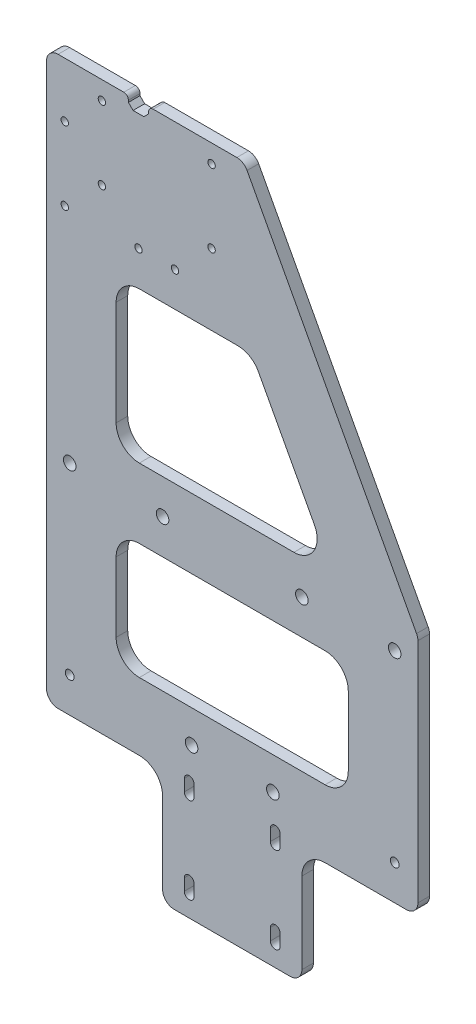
SolidWorks part; units mm, degrees
ref_plane "Front Plane" through (0, 0, 0) normal (0, 0, 1) x (1, 0, 0)
ref_plane "Top Plane" through (0, 0, 0) normal (0, 1, 0) x (1, 0, 0)
ref_plane "Right Plane" through (0, 0, 0) normal (1, 0, 0) x (0, 0, -1)
sketch "Sketch2" plane through (0, 0, 0) normal (0, 0, 1) x (1, 0, 0)
  line L0 (101.6, 0) -> (101.6, -203.2) construction
  line L1 (0, 0) -> (203.2, 0)
  line L2 (0, 0) -> (0, -203.2)
  line L3 (0, -203.2) -> (203.2, -203.2)
  line L4 (203.2, 0) -> (203.2, -203.2)
  line L5 (12.7, -12.7) -> (193.929, -12.7) construction
  line L6 (34.798, 0) -> (34.798, -203.2) construction
  line L7 (12.7, -113.03) -> (190.5, -113.03) construction
  circle A0 centre (63.5, -12.7) radius 3.429
  circle A1 centre (79.375, -113.03) radius 3.429
  circle A2 centre (190.5, -12.7) radius 3.429
  circle A3 centre (190.5, -113.03) radius 2.413
  circle A4 centre (123.825, -113.03) radius 3.429
  circle A5 centre (12.7, -12.7) radius 3.429
  circle A6 centre (139.7, -12.7) radius 3.429
  circle A7 centre (12.7, -113.03) radius 2.413
  dimension "D3" = 6.858
  dimension "D4" = 6.858
  dimension "D8" = 6.858
  dimension "D9" = 6.858
  dimension "D10" = 6.858
  dimension "D11" = 4.826
  dimension "D12" = 6.858
  dimension "D13" = 4.826
  dimension "D16" = 22.225
  dimension "D1" = 203.2
  dimension "D2" = 203.2
  dimension "D5" = 100.33
  dimension "D6" = 12.7
  dimension "D7" = 38.1
  dimension "D14" = 88.9
  dimension "D15" = 88.9
  dimension "D17" = 22.225
  dimension "D18" = 38.1
extrude "Boss-Extrude1" add sketch "Sketch2" along normal blind 6.35
ref_plane "Plane1" through (101.6, 0, 0) normal (1, 0, 0) x (0, 0, -1)
sketch "Sketch5" plane through (0, 0, 6.35) normal (0, 0, 1) x (1, 0, 0)
  line L0 (78.0542, -130.7592) -> (78.0542, -137.1092) construction
  line L1 (80.7212, -130.7592) -> (80.7212, -137.1092)
  line L2 (75.3872, -130.7592) -> (75.3872, -137.1092)
  line L3 (101.6, 0) -> (101.6, -203.2) construction
  line L4 (203.2, 0) -> (0, 0) construction
  line L5 (0, -203.2) -> (203.2, -203.2) construction
  line L6 (0, -157.48) -> (203.2, -157.48) construction
  line L7 (0, 0) -> (0, -203.2) construction
  line L8 (203.2, -203.2) -> (203.2, 0) construction
  line L9 (78.0542, -177.8508) -> (78.0542, -184.2008) construction
  line L10 (80.7212, -177.8508) -> (80.7212, -184.2008)
  line L11 (75.3872, -177.8508) -> (75.3872, -184.2008)
  line L12 (125.1458, -130.7592) -> (125.1458, -137.1092) construction
  line L13 (127.8128, -130.7592) -> (127.8128, -137.1092)
  line L14 (122.4788, -130.7592) -> (122.4788, -137.1092)
  line L15 (125.1458, -177.8508) -> (125.1458, -184.2008) construction
  line L16 (127.8128, -177.8508) -> (127.8128, -184.2008)
  line L17 (122.4788, -177.8508) -> (122.4788, -184.2008)
  arc A0 (80.7212, -130.7592) -> (75.3872, -130.7592) centre (78.0542, -130.7592) ccw
  arc A1 (75.3872, -137.1092) -> (80.7212, -137.1092) centre (78.0542, -137.1092) ccw
  circle A2 centre (123.825, -113.03) radius 3.429 construction
  arc A4 (80.7212, -177.8508) -> (75.3872, -177.8508) centre (78.0542, -177.8508) ccw
  arc A5 (75.3872, -184.2008) -> (80.7212, -184.2008) centre (78.0542, -184.2008) ccw
  arc A6 (127.8128, -130.7592) -> (122.4788, -130.7592) centre (125.1458, -130.7592) ccw
  arc A7 (122.4788, -137.1092) -> (127.8128, -137.1092) centre (125.1458, -137.1092) ccw
  arc A8 (127.8128, -177.8508) -> (122.4788, -177.8508) centre (125.1458, -177.8508) ccw
  arc A9 (122.4788, -184.2008) -> (127.8128, -184.2008) centre (125.1458, -184.2008) ccw
  point P2 (78.0542, -133.9342)
  point P19 (101.6, -157.48)
  point P21 (-20.2054, -139.5825)
  point P23 (78.0542, -181.0258)
  point P32 (125.1458, -133.9342)
  point P39 (125.1458, -181.0258)
  dimension "D5" = 44.45
  dimension "D3" = 6.35
  dimension "D7" = 6.35
  dimension "Slot Width" = 5.334
  dimension "Slot half-distance" = 23.5458
  dimension "D8" = 5.334
extrude "Cut-Extrude1" cut sketch "Sketch5" against normal through all
ref_plane "Plane2" through (78.0542, 0, 0) normal (1, 0, 0) x (0, 0, -1)
sketch "Sketch7" plane through (0, 0, 6.35) normal (0, 0, 1) x (1, 0, 0)
  line L0 (0, 0) -> (0, -203.2) construction
  line L1 (0, -132.1698) -> (63.5, -132.1698)
  line L2 (0, -132.1698) -> (0, -203.2)
  line L3 (0, -203.2) -> (47.625, -203.2)
  line L4 (63.5, -132.1698) -> (63.5, -195.58)
  line L5 (0, -203.2) -> (203.2, -203.2) construction
  line L6 (203.2, -203.2) -> (203.2, 0) construction
  line L7 (104.775, -203.2) -> (203.2, -203.2)
  line L8 (139.7, -195.58) -> (139.7, -132.1698)
  line L9 (139.7, -132.1698) -> (203.2, -132.1698)
  line L10 (203.2, -203.2) -> (203.2, -132.1698)
  line L11 (101.6, -3.4925) -> (101.6, 3.4925) construction
  line L13 (63.5, -195.58) -> (139.7, -195.58)
  line L15 (47.625, -203.2) -> (104.775, -203.2)
  circle A1 centre (12.7, -113.03) radius 2.413 construction
  dimension "D3" = 82.55
  dimension "D1" = 38.1
  dimension "D2" = 38.1
extrude "Cut-Extrude3" cut sketch "Sketch7" against normal through all
fillet "Fillet1" radius 12.7 2 edges at (63.5, -132.1698, 3.175) (139.7, -132.1698, 3.175)
fillet "Fillet2" radius 6.35 4 edges at (203.2, -132.1698, 3.175) (139.7, -195.58, 3.175) (63.5, -195.58, 3.175) (0, -132.1698, 3.175)
sketch "Sketch8" plane through (0, 0, 0) normal (0, 0, -1) x (-1, 0, 0)
  line L0 (-107.95, 177.8) -> (-203.2, 0)
  line L1 (0, 0) -> (-203.2, 0)
  line L2 (0, 0) -> (0, 177.8)
  line L3 (0, 177.8) -> (-107.95, 177.8)
  line L5 (-203.2, 0) -> (0, 0)
  dimension "D1" = 107.95
  dimension "D2" = 177.8
extrude "Boss-Extrude2" add sketch "Sketch8" against normal up to surface (6.35 mm away) contours L2 L3 L0 M22
fillet "Fillet3" radius 6.35 3 edges at (203.2, 0, 3.175) (107.95, 177.8, 3.175) (0, 177.8, 3.175)
sketch "Sketch9" plane through (0, 0, 0) normal (0, 0, -1) x (-1, 0, 0)
  circle A0 centre (-30.325, 167.8) radius 3.57 construction
  circle A1 centre (-30.325, 127.8) radius 3.57 construction
  circle A2 centre (-10, 147.8) radius 3.57 construction
  circle A3 centre (-10, 107.8) radius 3.57 construction
  circle A4 centre (-90.325, 167.8) radius 3.57 construction
  circle A5 centre (-90.325, 127.8) radius 3.57 construction
  circle A6 centre (-30.325, 167.8) radius 3.57
  circle A7 centre (-30.325, 127.8) radius 3.57
  circle A8 centre (-10, 147.8) radius 3.57
  circle A9 centre (-10, 107.8) radius 3.57
  circle A10 centre (-90.325, 167.8) radius 3.57
  circle A11 centre (-90.325, 127.8) radius 3.57
  circle A12 centre (-70.325, 107.8) radius 3.57 construction
  circle A13 centre (-50.325, 107.8) radius 3.57 construction
  circle A14 centre (-70.325, 107.8) radius 3.57
  circle A15 centre (-50.325, 107.8) radius 3.57
hole_wizard "#10-32 Tapped Hole1" positions "Sketch11" profile "Sketch10" tap size "#10-32" standard "Ansi Inch"
sketch "Sketch11" plane through (0, 0, 6.35) normal (0, 0, 1) x (1, 0, 0)
  point P0 (30.325, 167.8)
  point P4 (10, 147.8)
  point P6 (10, 107.8)
  point P8 (30.325, 127.8)
  point P10 (90.325, 127.8)
  point P12 (90.325, 167.8)
  point P22 (50.325, 107.8)
  point P24 (70.325, 107.8)
sketch "Sketch10" plane through (30.325, 167.8, 6.35) normal (1, 0, 0) x (0, -1, 0)
  line L0 (0, 0) -> (0, 6.35)
  line L1 (0, 6.35) -> (2.0193, 6.35)
  line L2 (2.0193, 6.35) -> (2.0193, 0)
  line L5 (2.0193, 0) -> (0, 0)
  line L11 (0, -6.35) -> (0, 107.95) construction
  dimension "Thread Major Dia." = 4.0386
  dimension "Thru Tap Drill Depth" = 6.35
sketch "Sketch12" plane through (0, 0, 6.35) normal (0, 0, 1) x (1, 0, 0)
  line L0 (109.7454, 174.4486) -> (202.4474, 1.4049) construction
  line L1 (38.1, 88.9) -> (112.3522, 88.9)
  line L2 (38.1, 88.9) -> (38.1, 6.35)
  line L3 (38.1, 6.35) -> (156.5755, 6.35)
  line L4 (112.3522, 88.9) -> (156.5755, 6.35)
  line L5 (38.1, -31.75) -> (165.1, -31.75)
  line L6 (38.1, -31.75) -> (38.1, -95.25)
  line L7 (38.1, -95.25) -> (165.1, -95.25)
  line L8 (165.1, -31.75) -> (165.1, -95.25)
  line L9 (0, 171.45) -> (0, -125.8198) construction
  line L10 (6.35, 177.8) -> (104.148, 177.8) construction
  dimension "D1" = 82.55
  dimension "D2" = 38.1
  dimension "D3" = 38.1
  dimension "D4" = 88.9
  dimension "D5" = 63.5
  dimension "D6" = 209.55
  dimension "D7" = 127
extrude "Cut-Extrude4" cut sketch "Sketch12" against normal through all
fillet "Fillet4" radius 12.7 8 edges at (165.1, -95.25, 3.175) (38.1, -95.25, 3.175) (38.1, -31.75, 3.175) (165.1, -31.75, 3.175) (156.5755, 6.35, 3.175) (38.1, 6.35, 3.175) (112.3522, 88.9, 3.175) (38.1, 88.9, 3.175)
sketch "Sketch13" plane through (0, 0, 6.35) normal (0, 0, 1) x (1, 0, 0)
  line L0 (44.8257, 176) -> (47.485, 176) construction
  line L1 (44.8257, 174.36) -> (44.8257, 176) construction
  line L2 (47.485, 171.7007) -> (44.8257, 174.36) construction
  line L3 (53.165, 171.7007) -> (47.485, 171.7007) construction
  line L4 (55.8243, 174.36) -> (53.165, 171.7007) construction
  line L5 (55.8243, 176) -> (55.8243, 174.36) construction
  line L6 (53.165, 176) -> (55.8243, 176) construction
  line L7 (54.965, 177.8) -> (53.165, 176) construction
  line L8 (47.485, 176) -> (45.685, 177.8) construction
  line L9 (44.8257, 176) -> (47.485, 176) construction
  line L10 (44.8257, 174.36) -> (44.8257, 176) construction
  line L11 (47.485, 171.7007) -> (44.8257, 174.36) construction
  line L12 (53.165, 171.7007) -> (47.485, 171.7007) construction
  line L13 (55.8243, 174.36) -> (53.165, 171.7007) construction
  line L14 (55.8243, 176) -> (55.8243, 174.36) construction
  line L15 (53.165, 176) -> (55.8243, 176) construction
  line L16 (54.965, 177.8) -> (53.165, 176) construction
  line L17 (47.485, 176) -> (45.685, 177.8) construction
  line L18 (6.35, 177.8) -> (104.148, 177.8) construction
  line L19 (44.8257, 176) -> (55.8243, 176)
  line L20 (44.8257, 176) -> (44.8257, 171.7007)
  line L21 (44.8257, 171.7007) -> (55.8243, 171.7007)
  line L22 (55.8243, 176) -> (55.8243, 171.7007)
  line L23 (6.35, 177.8) -> (104.148, 177.8)
  line L24 (44.8257, 176) -> (44.8257, 177.8)
  line L25 (44.8257, 177.8) -> (55.8243, 177.8)
  line L26 (55.8243, 177.8) -> (55.8243, 176)
extrude "Cut-Extrude5" cut sketch "Sketch13" against normal through all contours L22 L19 L20 L21 | L26 L23 L24 L19
fillet "Fillet6" radius 2.54 2 edges at (55.8243, 177.8, 3.175) (44.8257, 177.8, 3.175)
chamfer "Chamfer1" distance 2.54 angle 45 2 edges at (44.8257, 171.7007, 3.175) (55.8243, 171.7007, 3.175)
